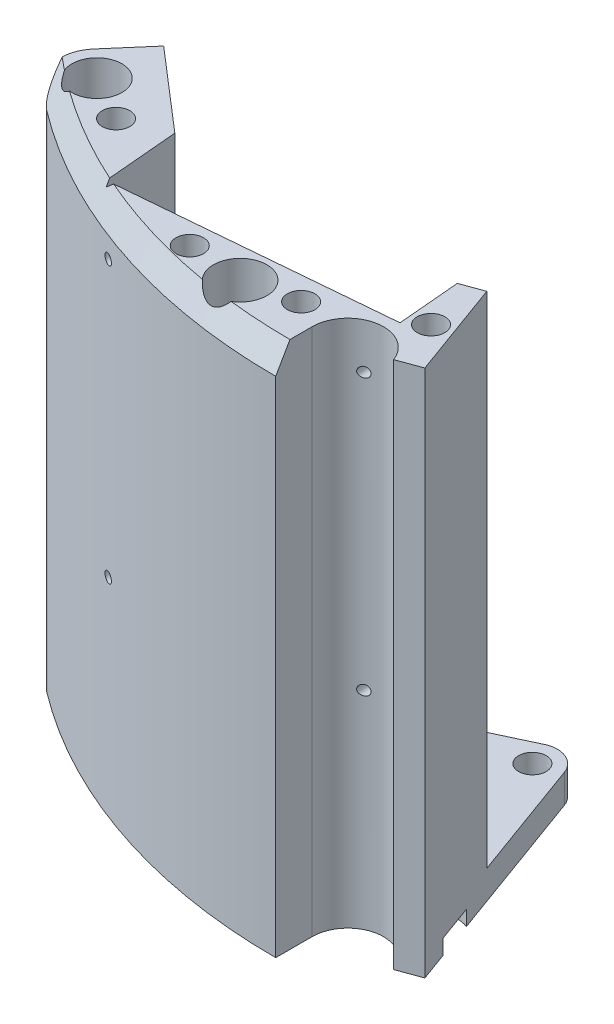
SolidWorks part; units mm, degrees
ref_plane "Front Plane" through (0, 0, 0) normal (0, 0, 1) x (1, 0, 0)
ref_plane "Top Plane" through (0, 0, 0) normal (0, 1, 0) x (1, 0, 0)
ref_plane "Right Plane" through (0, 0, 0) normal (1, 0, 0) x (0, 0, -1)
sketch "Sketch1" plane through (0, 0, 0) normal (0, 1, 0) x (1, 0, 0)
  line L0 (-62.2489, -71.8085) -> (-42.7983, -49.2543)
  line L1 (0, 0) -> (0, -130.1425) construction
  line L2 (-36.0909, -49.2256) -> (-29.4138, -56.8356)
  line L3 (2.1947, -52.4183) -> (16.4041, -91.4582)
  line L6 (0.0113, -101.6) -> (0.0105, -95.1145)
  line L7 (-21.9429, -58.3961) -> (-3.8707, -49.9147)
  line L8 (12.3276, -92.9419) -> (16.4041, -91.4582)
  line L9 (0, 0) -> (6.3605, -95.1138) construction
  line L11 (0, 0) -> (0.0113, -101.6) construction
  arc A0 (-61.2663, -81.0494) -> (0.0113, -101.6) centre (0, 0) ccw
  arc A1 (12.3276, -92.9419) -> (0.0105, -95.1145) centre (6.3605, -95.1138) ccw
  circle A2 centre (6.3605, -95.1138) radius 4.7625 construction
  circle A3 centre (-57.4254, -75.9683) radius 1.7272 construction
  arc A5 (-36.0909, -49.2256) -> (-42.7983, -49.2543) centre (-39.4321, -52.1572) ccw
  circle A6 centre (-39.4321, -52.1572) radius 1.7272 construction
  arc A8 (-29.4138, -56.8356) -> (-21.9429, -58.3961) centre (-24.6407, -52.6476) ccw
  circle A9 centre (-1.9822, -53.9386) radius 1.7272 construction
  circle A10 centre (-24.6407, -52.6476) radius 4.658 construction
  arc A12 (-3.8707, -49.9147) -> (2.1947, -52.4183) centre (-1.9822, -53.9386) cw
  arc A13 (-61.2663, -81.0494) -> (-62.2489, -71.8085) centre (-57.4254, -75.9683) cw
  dimension "D1" = 101.6
  dimension "D2" = 20
  dimension "D3" = 6.35
  dimension "D7" = 12.7
  dimension "D6" = 4.445
  dimension "D5" = 4.445
extrude "Boss-Extrude1" add sketch "Sketch1" along normal blind 5.08
sketch "Sketch2" plane through (0, 5.08, 0) normal (0, 1, 0) x (1, 0, 0)
  line L0 (0, 0) -> (0, -120.1131) construction
  line L3 (14.44, -86.0621) -> (-44.7041, -91.2365)
  line L4 (16.4041, -91.4582) -> (2.1947, -52.4183) construction
  line L6 (12.3276, -92.9419) -> (16.4041, -91.4582)
  line L8 (16.4041, -91.4582) -> (14.44, -86.0621)
  line L17 (0.0113, -101.6) -> (0.0105, -95.1145)
  line L19 (0.0113, -101.6) -> (0.0105, -95.1145)
  line L22 (-22.6721, -89.3089) -> (-27.0996, -38.7023) construction
  arc A0 (12.3276, -92.9419) -> (0.0105, -95.1145) centre (6.3605, -95.1138) ccw construction
  arc A2 (-44.7041, -91.2365) -> (0.0113, -101.6) centre (0, 0) ccw
  arc A16 (-61.2663, -81.0494) -> (0.0113, -101.6) centre (0, 0) ccw
  arc A17 (12.3276, -92.9419) -> (0.0105, -95.1145) centre (6.3605, -95.1138) ccw
  arc A20 (12.3276, -92.9419) -> (0.0105, -95.1145) centre (6.3605, -95.1138) ccw
  point P25 (8.4175, -89.1061)
  point P27 (6.8148, -86.7292)
  dimension "D3" = 50.8
  dimension "D1" = 0
  dimension "D4" = 85
extrude "Boss-Extrude2" add sketch "Sketch2" along normal blind 88.9
hole_wizard "CBORE for #8 Binding Head Machine Screw1" positions "Sketch20" profile "Sketch21" counterbore size "#8" standard "ANSI Inch"
sketch "Sketch20" plane through (0, 93.98, 0) normal (0, 1, 0) x (1, 0, 0)
  circle A0 centre (-13.5537, -94.3577) radius 2.0828 construction
  point P0 (-13.5537, -94.3577)
sketch "Sketch21" plane through (-13.5537, 93.98, 94.3577) normal (1, 0, 0) x (0, 0, 1)
  line L0 (0, 0) -> (0, 93.98)
  line L1 (0, 93.98) -> (2.4574, 93.98)
  line L3 (2.4574, 93.98) -> (2.4574, 63.5)
  line L4 (2.4574, 63.5) -> (4.7625, 63.5)
  line L5 (4.7625, 63.5) -> (4.7625, 0)
  line L7 (4.7625, 0) -> (0, 0)
  line L11 (0, -6.35) -> (0, 107.95) construction
  dimension "Thru Hole Dia." = 4.9149
  dimension "Thru Hole Depth" = 93.98
  dimension "C'Bore Dia." = 9.525
  dimension "C'Bore Depth" = 63.5
hole_wizard "#10 (0.1935) Diameter Hole2" positions "Sketch9" profile "Sketch10" hole size "#10" standard "ANSI Inch"
sketch "Sketch9" plane through (0, 5.08, 0) normal (0, 1, 0) x (1, 0, 0)
  circle A0 centre (44.4969, -84.3037) radius 2.0828 construction
  circle A1 centre (-1.9822, -53.9386) radius 2.0828 construction
  circle A3 centre (-57.4254, -75.9683) radius 2.0828 construction
  circle A4 centre (-39.4321, -52.1572) radius 2.0828 construction
  point P0 (44.4969, -84.3037)
  point P2 (-1.9822, -53.9386)
  point P18 (-57.4254, -75.9683)
  point P20 (-39.4321, -52.1572)
sketch "Sketch10" plane through (44.4969, 5.08, 84.3037) normal (1, 0, 0) x (0, 0, 1)
  line L0 (0, 0) -> (0, 5.08)
  line L1 (0, 5.08) -> (2.4574, 5.08)
  line L2 (2.4574, 5.08) -> (2.4574, 0)
  line L5 (2.4574, 0) -> (0, 0)
  line L11 (0, -6.35) -> (0, 107.95) construction
  dimension "Thru Hole Dia." = 4.9149
  dimension "Thru Hole Depth" = 5.08
hole_wizard "#6-32 Tapped Hole1" positions "Sketch12" profile "Sketch13" tap size "#6-32" standard "ANSI Inch"
sketch "Sketch12" plane through (0, 5.08, 0) normal (0, 1, 0) x (1, 0, 0)
  circle A0 centre (-7.2007, -71.4575) radius 2.05 construction
  arc A1 (-37.1569, -76.1362) -> (-37.5143, -72.0518) centre (-37.3356, -74.094) ccw construction
  point P0 (-37.3356, -74.094)
  point P3 (-7.2007, -71.4575)
sketch "Sketch13" plane through (-37.3356, 5.08, 74.094) normal (1, 0, 0) x (0, 0, 1)
  line L0 (0, 0) -> (0, 5.08)
  line L1 (0, 5.08) -> (1.3525, 5.08)
  line L2 (1.3525, 5.08) -> (1.3525, 0)
  line L5 (1.3525, 0) -> (0, 0)
  line L11 (0, -6.35) -> (0, 107.95) construction
  dimension "Thread Major Dia." = 2.7051
  dimension "Thru Tap Drill Depth" = 5.08
hole_wizard "#2-56 Tapped Hole1" positions "Sketch15" profile "Sketch16" tap size "#2-56" standard "ANSI Inch"
sketch "Sketch15" plane through (7.5819, 0, 86.6621) normal (-0.0872, 0, -0.9962) x (-0.9962, 0, 0.0872)
  circle A0 centre (44.7392, 36.9) radius 1.35 construction
  circle A1 centre (44.7392, 85.9) radius 1.35 construction
  circle A2 centre (4.2392, 85.9) radius 1.35 construction
  circle A3 centre (4.2392, 36.9) radius 1.35 construction
  point P0 (4.2392, 85.9)
  point P2 (44.7392, 36.9)
  point P4 (4.2392, 36.9)
  point P6 (44.7392, 85.9)
sketch "Sketch16" plane through (3.3589, 85.9, 87.0315) normal (0, 1, 0) x (-0.9962, 0, 0.0872)
  line L0 (0, 0) -> (0, 15.65)
  line L1 (0, 15.65) -> (0.889, 15.65)
  line L2 (0.889, 15.65) -> (0.889, 0)
  line L5 (0.889, 0) -> (0, 0)
  line L11 (0, -6.35) -> (0, 107.95) construction
  dimension "Thread Major Dia." = 1.778
  dimension "Thru Tap Drill Depth" = 15.65
sketch "Sketch23" plane through (0, 93.98, 0) normal (0, 1, 0) x (1, 0, 0)
  line L0 (7.2241, -86.6934) -> (6.2474, -75.5289)
  line L1 (14.44, -86.0621) -> (-44.7041, -91.2365) construction
  line L2 (6.2474, -75.5289) -> (10.0964, -74.128)
  line L3 (14.44, -86.0621) -> (2.1947, -52.4183) construction
  line L4 (10.0964, -74.128) -> (14.44, -86.0621)
  line L5 (14.44, -86.0621) -> (7.2241, -86.6934)
  line L6 (14.44, -86.0621) -> (-44.7041, -91.2365) construction
  line L7 (-40.8522, -90.8995) -> (-42.0235, -77.5115)
  line L8 (-16.814, -88.7964) -> (-17.5472, -80.4164) construction
  line L9 (-36.987, -90.5613) -> (3.3589, -87.0315) construction
  line L10 (-44.7041, -91.2365) -> (-40.8522, -90.8995)
  line L11 (-42.0235, -77.5115) -> (-56.443, -65.0762)
  line L12 (-42.7983, -49.2543) -> (-62.2489, -71.8085)
  line L13 (-56.443, -65.0762) -> (-62.2489, -71.8085)
  circle A0 centre (-57.4254, -75.9683) radius 4.445
  arc A3 (-61.2663, -81.0494) -> (-44.7041, -91.2365) centre (0, 0) ccw
  arc A4 (-61.2663, -81.0494) -> (-44.7041, -91.2365) centre (0, 0) ccw
  arc A7 (-62.2489, -71.8085) -> (-61.2663, -81.0494) centre (-57.4254, -75.9683) ccw
  arc A8 (-62.2489, -71.8085) -> (-61.2663, -81.0494) centre (-57.4254, -75.9683) ccw
  dimension "D8" = 8.89
  dimension "D2" = 48.26
  dimension "D4" = 0
  dimension "D6" = 12.7
  dimension "D7" = 8.89
  dimension "D3" = 0
extrude "Boss-Extrude6" add sketch "Sketch23" against normal up to surface (88.9 mm away)
sketch "Sketch14" plane through (0, 0, 0) normal (1, 0, 0) x (0, 0, -1)
  line L0 (-101.6, 93.98) -> (-99.06, 93.98)
  line L1 (-101.6, 93.98) -> (-95.1145, 93.98) construction
  line L2 (-99.06, 93.98) -> (-101.6, 89.5806)
  line L3 (-101.6, 89.5806) -> (-101.6, 93.98)
  line L4 (0, 0) -> (0, 40.5659) construction
  dimension "D1" = 2.54
  dimension "D2" = 60
revolve "Cut-Revolve2" cut sketch "Sketch14" angle 360 about L4
hole_wizard "CBORE for #8 Binding Head Machine Screw2" positions "Sketch24" profile "Sketch25" counterbore size "#8" standard "ANSI Inch"
sketch "Sketch24" plane through (0, 0, 0) normal (0, -1, 0) x (-1, 0, 0)
  point P0 (49.4893, -80.5009)
  point P4 (4.8165, -92.2453)
  point P8 (23.3567, -93.523)
  point P11 (-10.2757, -84.2328)
sketch "Sketch25" plane through (-49.4893, 0, 80.5009) normal (1, 0, 0) x (0, 0, -1)
  line L0 (0, 0) -> (0, 93.98)
  line L1 (0, 93.98) -> (2.4574, 93.98)
  line L3 (2.4574, 93.98) -> (2.4575, 2.667)
  line L4 (2.4575, 2.667) -> (4.7625, 2.667)
  line L5 (4.7625, 2.667) -> (4.7625, 0)
  line L7 (4.7625, 0) -> (0, 0)
  line L11 (0, -6.35) -> (0, 107.95) construction
  dimension "Thru Hole Dia." = 4.9149
  dimension "Thru Hole Depth" = 93.98
  dimension "C'Bore Dia." = 9.525
  dimension "C'Bore Depth" = 2.667
